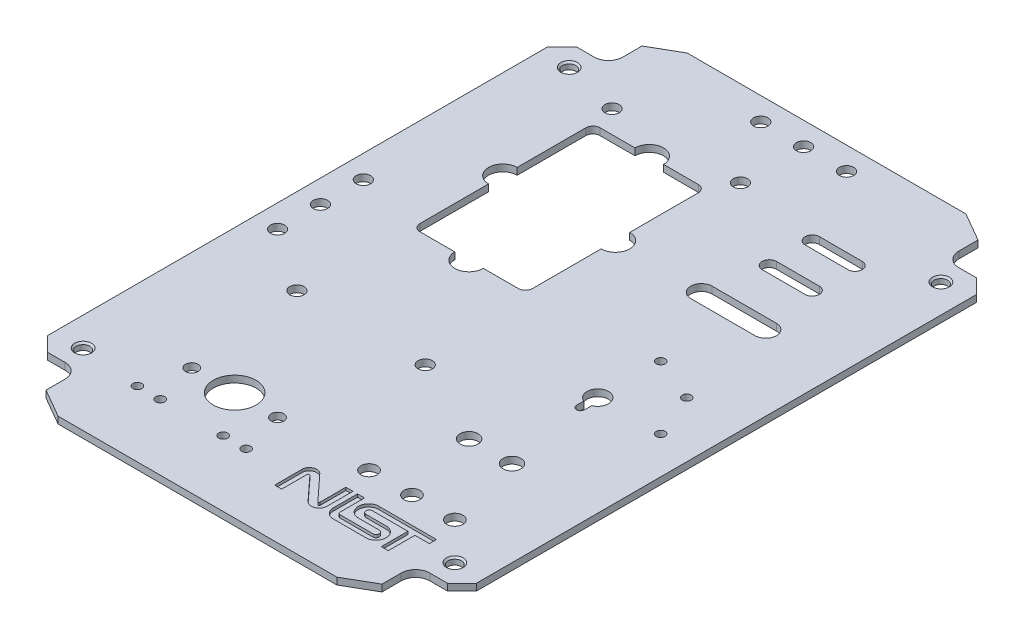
SolidWorks part; units mm, degrees
other "DetailItem1"
ref_plane "Front Plane" through (0, 0, 0) normal (0, 0, 1) x (1, 0, 0)
ref_plane "Top Plane" through (0, 0, 0) normal (0, 1, 0) x (1, 0, 0)
ref_plane "Right Plane" through (0, 0, 0) normal (1, 0, 0) x (0, 0, -1)
sketch "Sketch1" plane through (0, 0, 0) normal (0, 1, 0) x (1, 0, 0)
  line L0 (0, -55) -> (0, 55) construction
  line L1 (-74.6125, 139.7) -> (74.6125, 139.7)
  line L2 (-95.25, 117.475) -> (-95.25, -117.475)
  line L3 (-74.6125, -139.7) -> (74.6125, -139.7)
  line L4 (95.25, 117.475) -> (95.25, -117.475)
  line L5 (-55, 0) -> (55, 0) construction
  line L7 (-95.25, 117.475) -> (-74.6125, 117.475)
  line L8 (-74.6125, 139.7) -> (-74.6125, 117.475)
  line L9 (-95.25, -117.475) -> (-74.6125, -117.475)
  line L12 (-74.6125, -117.475) -> (-74.6125, -139.7)
  line L13 (74.6125, -117.475) -> (95.25, -117.475)
  line L14 (74.6125, -117.475) -> (74.6125, -139.7)
  line L22 (74.6125, 139.7) -> (74.6125, 117.475)
  line L23 (74.6125, 117.475) -> (95.25, 117.475)
  dimension "D1" = 190.5
  dimension "D2" = 95.25
  dimension "D3" = 279.4
  dimension "D4" = 139.7
  dimension "D5" = 234.95
  dimension "D6" = 117.475
  dimension "D7" = 149.225
  dimension "D8" = 74.6125
extrude "Boss-Extrude1" add sketch "Sketch1" along normal blind 3.0378
hole_wizard "15/64 (0.23438) Diameter Hole1" positions "Sketch4" profile "Sketch2" hole size "15/64" standard "ANSI Inch"
sketch "Sketch4" plane through (0, 3.0378, 0) normal (0, 1, 0) x (1, 0, 0)
  line L0 (0, -1.6708) -> (0, 1.6708) construction
  line L1 (-1.6708, 0) -> (1.6708, 0) construction
  point P0 (-82.55, -107.95)
  dimension "D1" = 82.55
  dimension "D2" = 107.95
sketch "Sketch2" plane through (-82.55, 3.0378, 107.95) normal (1, 0, 0) x (0, 0, 1)
  line L0 (0, 0) -> (0, 4.8225)
  line L1 (0, 4.8225) -> (2.9718, 3.0368)
  line L2 (2.9718, 3.0368) -> (2.9718, 0)
  line L5 (2.9718, 0) -> (0, 0)
  line L10 (0, 4.8225) -> (-2.9718, 3.0368) construction
  line L11 (0, -6.35) -> (0, 107.95) construction
  dimension "Hole Dia." = 5.9436
  dimension "Hole Depth" = 3.0368
  dimension "Drill Angle" = 118
pattern_linear "LPattern1" count 2 spacing 165.1 along (1, 0, 0) count 2 spacing 215.9 along (0, 0, -1) of "15/64 (0.23438) Diameter Hole1"
fillet "Fillet1" radius 6.35 4 edges at (74.6125, 1.5189, 117.475) (74.6125, 1.5189, -117.475) (-74.6125, 1.5189, -117.475) (-74.6125, 1.5189, 117.475)
hole_wizard "1/4 (0.25) Diameter Hole2" positions "Sketch6" profile "Sketch5" hole size "1/4" standard "ANSI Inch"
sketch "Sketch6" plane through (0, 3.0378, 0) normal (0, 1, 0) x (1, 0, 0)
  line L2 (0, -1.6708) -> (0, 1.6708) construction
  point P0 (-19.05, 129.54)
  dimension "D1" = 21.59
  dimension "D2" = 19.05
sketch "Sketch5" plane through (-19.05, 3.0378, -129.54) normal (1, 0, 0) x (0, 0, 1)
  line L0 (0, 0) -> (0, 4.9446)
  line L1 (0, 4.9446) -> (3.175, 3.0368)
  line L2 (3.175, 3.0368) -> (3.175, 0)
  line L5 (3.175, 0) -> (0, 0)
  line L10 (0, 4.9446) -> (-3.175, 3.0368) construction
  line L11 (0, -6.35) -> (0, 107.95) construction
  dimension "Hole Dia." = 6.35
  dimension "Hole Depth" = 3.0368
  dimension "Drill Angle" = 118
pattern_linear "LPattern2" count 3 spacing 19.05 along (1, 0, 0) of "1/4 (0.25) Diameter Hole2"
hole_wizard "1/4 (0.25) Diameter Hole3" positions "Sketch8" profile "Sketch7" hole size "1/4" standard "ANSI Inch"
sketch "Sketch8" plane through (0, 3.0378, 0) normal (0, 1, 0) x (1, 0, 0)
  point P0 (-57.15, 101.6)
  dimension "D1" = 6.35
  dimension "D2" = 25.4
sketch "Sketch7" plane through (-57.15, 3.0378, -101.6) normal (1, 0, 0) x (0, 0, 1)
  line L0 (0, 0) -> (0, 4.9446)
  line L1 (0, 4.9446) -> (3.175, 3.0368)
  line L2 (3.175, 3.0368) -> (3.175, 0)
  line L5 (3.175, 0) -> (0, 0)
  line L10 (0, 4.9446) -> (-3.175, 3.0368) construction
  line L11 (0, -6.35) -> (0, 107.95) construction
  dimension "Hole Dia." = 6.35
  dimension "Hole Depth" = 3.0368
  dimension "Drill Angle" = 118
pattern_linear "LPattern3" count 2 spacing 139.9997 along (0, 0, 1) count 2 spacing 56.9999 along (1, 0, 0) of "1/4 (0.25) Diameter Hole3"
sketch "Sketch9" plane through (0, 3.0378, 0) normal (0, 1, 0) x (1, 0, 0)
  line L0 (-55.65, 51.6) -> (-5.65, 51.6) construction
  line L1 (-55.65, 91.6) -> (-37, 91.6)
  line L2 (-55.65, 91.6) -> (-55.65, 57.95)
  line L3 (-55.65, 11.6) -> (-37, 11.6)
  line L4 (-5.65, 91.6) -> (-5.65, 57.95)
  line L5 (-30.65, 91.6) -> (-30.65, 11.6) construction
  line L6 (-24.3, 91.6) -> (-5.65, 91.6)
  line L7 (-55.65, 45.25) -> (-55.65, 11.6)
  line L8 (-24.3, 11.6) -> (-5.65, 11.6)
  line L9 (-5.65, 45.25) -> (-5.65, 11.6)
  arc A0 (-55.65, 57.95) -> (-55.65, 45.25) centre (-55.65, 51.6) ccw
  arc A1 (-24.3, 91.6) -> (-37, 91.6) centre (-30.65, 91.6) ccw
  arc A2 (-5.65, 45.25) -> (-5.65, 57.95) centre (-5.65, 51.6) ccw
  arc A3 (-37, 11.6) -> (-24.3, 11.6) centre (-30.65, 11.6) ccw
  dimension "D1" = 12.7
  dimension "D2" = 1.5
  dimension "D3" = 10
  dimension "D4" = 33.65
  dimension "D5" = 18.65
extrude "Cut-Extrude1" cut sketch "Sketch9" against normal through all
chamfer "Chamfer1" distance 0.762 distance2 0.762 4 edges at (-82.55, 3.0378, -104.9782) (82.55, 3.0378, -104.9782) (82.55, 3.0378, 110.9218) (-82.55, 3.0378, 110.9218)
chamfer "Chamfer2" distance 6.35 angle 45 4 edges at (-95.25, 1.5189, -117.475) (95.25, 1.5189, -117.475) (95.25, 1.5189, 117.475) (-95.25, 1.5189, 117.475)
chamfer "Chamfer3" distance 12.7 angle 30 2 edges at (74.6125, 1.5189, -139.7) (-74.6125, 1.5189, -139.7)
chamfer "Chamfer4" distance 12.7 angle 30 2 edges at (74.6125, 1.5189, 139.7) (-74.6125, 1.5189, 139.7)
hole_wizard "#2 (0.221) Diameter Hole1" positions "Sketch11" profile "Sketch10" hole size "#2" standard "ANSI Inch"
sketch "Sketch11" plane through (0, 3.0378, 0) normal (0, 1, 0) x (1, 0, 0)
  point P0 (-50.8, -91.44)
  dimension "D1" = 16.51
  dimension "D2" = 31.75
sketch "Sketch10" plane through (-50.8, 3.0378, 91.44) normal (1, 0, 0) x (0, 0, 1)
  line L0 (0, 0) -> (0, 4.7233)
  line L1 (0, 4.7233) -> (2.8067, 3.0368)
  line L2 (2.8067, 3.0368) -> (2.8067, 0)
  line L5 (2.8067, 0) -> (0, 0)
  line L10 (0, 4.7233) -> (-2.8067, 3.0368) construction
  line L11 (0, -6.35) -> (0, 107.95) construction
  dimension "Hole Dia." = 5.6134
  dimension "Hole Depth" = 3.0368
  dimension "Drill Angle" = 118
pattern_linear "LPattern4" count 2 spacing 38.1 along (1, 0, 0) of "#2 (0.221) Diameter Hole1"
hole_wizard "3/4 (0.75) Diameter Hole1" positions "Sketch13" profile "Sketch12" hole size "3/4" standard "ANSI Inch"
sketch "Sketch13" plane through (0, 3.0378, 0) normal (0, 1, 0) x (1, 0, 0)
  point P10 (-31.75, -91.44)
  dimension "D1" = 19.05
  dimension "D2" = 0
sketch "Sketch12" plane through (-31.75, 3.0378, 91.44) normal (1, 0, 0) x (0, 0, 1)
  line L0 (0, 0) -> (0, 3.0378)
  line L1 (0, 3.0378) -> (9.525, 3.0378)
  line L2 (9.525, 3.0378) -> (9.525, 0)
  line L5 (9.525, 0) -> (0, 0)
  line L11 (0, -6.35) -> (0, 107.95) construction
  dimension "Thru Hole Dia." = 19.05
  dimension "Thru Hole Depth" = 3.0378
hole_wizard "K (0.281) Diameter Hole1" positions "Sketch15" profile "Sketch14" hole size "K" standard "ANSI Inch"
sketch "Sketch15" plane through (0, 3.0378, 0) normal (0, 1, 0) x (1, 0, 0)
  point P0 (27.94, -91.44)
  dimension "D1" = 110.49
  dimension "D2" = 16.51
sketch "Sketch14" plane through (27.94, 3.0378, 91.44) normal (1, 0, 0) x (0, 0, 1)
  line L0 (0, 0) -> (0, 5.1811)
  line L1 (0, 5.1811) -> (3.5687, 3.0368)
  line L2 (3.5687, 3.0368) -> (3.5687, 0)
  line L5 (3.5687, 0) -> (0, 0)
  line L10 (0, 5.1811) -> (-3.5687, 3.0368) construction
  line L11 (0, -6.35) -> (0, 107.95) construction
  dimension "Hole Dia." = 7.1374
  dimension "Hole Depth" = 3.0368
  dimension "Drill Angle" = 118
pattern_linear "LPattern6" count 3 spacing 19.05 along (1, 0, 0) of "K (0.281) Diameter Hole1"
sketch "Sketch16" plane through (0, 3.0378, 0) normal (0, 1, 0) x (1, 0, 0)
  line L3 (52.578, -17.1182) -> (52.578, -20.32)
  line L5 (49.022, -17.1182) -> (49.022, -20.32)
  arc A0 (49.022, -20.32) -> (52.578, -20.32) centre (50.8, -20.32) ccw
  arc A1 (52.578, -17.1182) -> (49.022, -17.1182) centre (50.8, -12.7) ccw
  dimension "D1" = 31.75
  dimension "D3" = 7.62
  dimension "D4" = 9.525
  dimension "D5" = 1.778
  dimension "D2" = 95.25
extrude "Cut-Extrude2" cut sketch "Sketch16" against normal through all
hole_wizard "5/32 (0.15625) Diameter Hole1" positions "Sketch18" profile "Sketch17" hole size "5/32" standard "ANSI Inch"
sketch "Sketch18" plane through (0, 3.0378, 0) normal (0, 1, 0) x (1, 0, 0)
  point P0 (50.8, 15.24)
  dimension "D1" = 0
  dimension "D2" = 27.94
sketch "Sketch17" plane through (50.8, 3.0378, -15.24) normal (1, 0, 0) x (0, 0, 1)
  line L0 (0, 0) -> (0, 3.0378)
  line L1 (0, 3.0378) -> (1.9844, 3.0378)
  line L2 (1.9844, 3.0378) -> (1.9844, 0)
  line L5 (1.9844, 0) -> (0, 0)
  line L11 (0, -6.35) -> (0, 107.95) construction
  dimension "Thru Hole Dia." = 3.9688
  dimension "Thru Hole Depth" = 3.0378
pattern_circular "CirPattern1" count 3 every 45 about axis through (50.8, 0, 12.7) along (0, 1, 0) of "5/32 (0.15625) Diameter Hole1"
sketch "Sketch19" plane through (0, 3.0378, 0) normal (0, 1, 0) x (1, 0, 0)
  line L0 (57.15, 95.25) -> (38.1, 95.25) construction
  line L1 (57.15, 92.075) -> (38.1, 92.075)
  line L2 (57.15, 98.425) -> (38.1, 98.425)
  arc A0 (57.15, 92.075) -> (57.15, 98.425) centre (57.15, 95.25) ccw
  arc A1 (38.1, 98.425) -> (38.1, 92.075) centre (38.1, 95.25) ccw
  point P2 (47.625, 95.25)
  dimension "D3" = 12.7
  dimension "D4" = 19.05
  dimension "D1" = 3.175
  dimension "D2" = 34.925
extrude "Cut-Extrude3" cut sketch "Sketch19" against normal blind 3.0378
pattern_linear "LPattern7" count 2 spacing 19.05 along (0, 0, 1) of "Cut-Extrude3"
sketch "Sketch20" plane through (0, 3.0378, 0) normal (0, 1, 0) x (1, 0, 0)
  line L0 (61.9125, 50.8) -> (33.3375, 50.8) construction
  line L1 (61.9125, 46.0375) -> (33.3375, 46.0375)
  line L2 (61.9125, 55.5625) -> (33.3375, 55.5625)
  arc A0 (61.9125, 46.0375) -> (61.9125, 55.5625) centre (61.9125, 50.8) ccw
  arc A1 (33.3375, 55.5625) -> (33.3375, 46.0375) centre (33.3375, 50.8) ccw
  point P2 (47.625, 50.8)
  dimension "D4" = 34.925
  dimension "D2" = 28.575
  dimension "D1" = 9.525
  dimension "D3" = 57.15
extrude "Cut-Extrude4" cut sketch "Sketch20" against normal blind 3.0378
hole_wizard "1/4 (0.25) Diameter Hole6" positions "Sketch22" profile "Sketch21" hole size "1/4" standard "ANSI Inch"
sketch "Sketch22" plane through (0, 3.0378, 0) normal (0, 1, 0) x (1, 0, 0)
  line L1 (-1.6708, 0) -> (1.6708, 0) construction
  point P0 (-85.09, -19.05)
  dimension "D1" = 19.05
  dimension "D2" = 2.54
sketch "Sketch21" plane through (-85.09, 3.0378, 19.05) normal (1, 0, 0) x (0, 0, 1)
  line L0 (0, 0) -> (0, 3.0378)
  line L1 (0, 3.0378) -> (3.175, 3.0378)
  line L2 (3.175, 3.0378) -> (3.175, 0)
  line L5 (3.175, 0) -> (0, 0)
  line L11 (0, -6.35) -> (0, 107.95) construction
  dimension "Thru Hole Dia." = 6.35
  dimension "Thru Hole Depth" = 3.0378
pattern_linear "LPattern8" count 3 spacing 19.05 along (0, 0, -1) of "1/4 (0.25) Diameter Hole6"
fillet "Fillet2" radius 3.175 4 edges at (-5.65, 1.5189, -11.6) (-5.65, 1.5189, -91.6) (-55.65, 1.5189, -11.6) (-55.65, 1.5189, -91.6)
hole_wizard "5/32 (0.15625) Diameter Hole2" positions "Sketch26" profile "Sketch25" hole size "5/32" standard "ANSI Inch"
sketch "Sketch26" plane through (0, 3.0378, 0) normal (0, 1, 0) x (1, 0, 0)
  point P0 (-45.72, -110.49)
  dimension "D1" = 19.05
  dimension "D2" = 13.97
sketch "Sketch25" plane through (-45.72, 3.0378, 110.49) normal (1, 0, 0) x (0, 0, 1)
  line L0 (0, 0) -> (0, 4.2292)
  line L1 (0, 4.2292) -> (1.9844, 3.0368)
  line L2 (1.9844, 3.0368) -> (1.9844, 0)
  line L5 (1.9844, 0) -> (0, 0)
  line L10 (0, 4.2292) -> (-1.9844, 3.0368) construction
  line L11 (0, -6.35) -> (0, 107.95) construction
  dimension "Hole Dia." = 3.9688
  dimension "Hole Depth" = 3.0368
  dimension "Drill Angle" = 118
pattern_linear "LPattern9" count 2 spacing 10.16 along (-1, 0, 0) of "5/32 (0.15625) Diameter Hole2"
pattern_linear "LPattern10" count 2 spacing 38.1 along (1, 0, 0) of "LPattern9"
hole_wizard "O (0.316) Diameter Hole1" positions "Sketch28" profile "Sketch27" hole size "O" standard "ANSI Inch"
sketch "Sketch28" plane through (0, 3.0378, 0) normal (0, 1, 0) x (1, 0, 0)
  point P0 (57.15, -57.15)
  dimension "D1" = 50.8
  dimension "D2" = 25.4
sketch "Sketch27" plane through (57.15, 3.0378, 57.15) normal (1, 0, 0) x (0, 0, 1)
  line L0 (0, 0) -> (0, 3.0378)
  line L1 (0, 3.0378) -> (4.0005, 3.0378)
  line L2 (4.0005, 3.0378) -> (4.0005, 0)
  line L5 (4.0005, 0) -> (0, 0)
  line L11 (0, -6.35) -> (0, 107.95) construction
  dimension "Thru Hole Dia." = 8.001
  dimension "Thru Hole Depth" = 3.0378
pattern_linear "LPattern11" count 2 spacing 19.05 along (-1, 0, 0) of "O (0.316) Diameter Hole1"
ref_point "Point1"
sketch "Sketch29" plane through (0, 3.0378, 0) normal (0, 1, 0) x (1, 0, 0)
  line L0 (-0.1501, -38.3997) -> (-57.15, 101.6) construction
  line L1 (-0.1501, 101.6) -> (-57.15, -38.3997) construction
  point P8 (-28.6501, 31.6001)
ref_point "Point2"
ref_point "Point3"
sketch "Sketch30" plane through (0, 3.0378, 0) normal (0, 1, 0) x (1, 0, 0)
  line L0 (82.3369, 0.762) -> (82.3369, -2.54)
  line L1 (82.3369, -2.54) -> (84.5723, -1.769)
  line L2 (84.5723, -1.769) -> (82.3369, 0.762)
  line L3 (64.3575, 18.796) -> (61.8655, 20.9623)
  line L4 (61.8655, 20.9623) -> (60.9808, 18.7695)
  line L5 (60.9808, 18.7695) -> (64.3575, 18.796)
  arc A0 (64.3575, 18.796) -> (82.3369, 0.762) centre (50.8, -12.7) ccw
  text T0 "C" font "Century Schoolbook" height 7.62
  dimension "D1" = 68.58
  dimension "D2" = 31.496
  dimension "D3" = 70.97
  dimension "D4" = 41.45
  dimension "D5" = 3.302
  dimension "D6" = 21.59
  dimension "D7" = 21.844
  dimension "D8" = 41.45
sketch "Sketch31" plane through (0, 3.0378, 0) normal (0, 1, 0) x (1, 0, 0)
  line L0 (50.8, 10.16) -> (50.8, 20.32)
  line L1 (66.9645, 3.4645) -> (74.1487, 10.6487)
  line L2 (73.66, -12.7) -> (83.82, -12.7)
  arc A0 (74.2176, 2.54) -> (66.8644, 10.16) centre (50.8, -12.7) ccw
  dimension "D1" = 10.16
  dimension "D2" = 45
  dimension "D3" = 15.24
  dimension "D4" = 22.86
sketch "Sketch32" plane through (0, 3.0378, 0) normal (0, 1, 0) x (1, 0, 0)
  line L0 (66.04, -83.82) -> (66.04, -99.06)
  line L1 (58.42, -91.44) -> (73.66, -91.44)
  dimension "D1" = 15.24
sketch "Sketch33" plane through (0, 3.0378, 0) normal (0, 1, 0) x (1, 0, 0)
  line L0 (0, -1.6708) -> (0, 1.6708) construction
  line L1 (-61.9125, -139.7) -> (61.9125, -139.7) construction
  line L2 (34.4811, -103.11) -> (34.4811, -113.9143)
  line L3 (38.6768, -118.11) -> (53.8773, -118.11)
  line L4 (53.8773, -109.0871) -> (44.2506, -109.0871)
  line L5 (44.3655, -106.271) -> (60.0556, -106.271)
  line L6 (60.0556, -106.271) -> (60.0556, -118.11)
  line L7 (60.0556, -118.11) -> (63.1581, -118.11)
  line L8 (63.1581, -118.11) -> (63.1581, -106.271)
  line L9 (63.1581, -106.271) -> (69.5674, -106.271)
  line L10 (69.5674, -106.271) -> (69.5674, -103.11)
  line L11 (69.5674, -103.11) -> (43.9641, -103.11)
  line L12 (44.3081, -112.1904) -> (53.3599, -112.1904)
  line L13 (53.4174, -115.0068) -> (38.7059, -115.0068)
  line L14 (37.6134, -113.9143) -> (37.6134, -103.11)
  line L15 (37.6134, -103.11) -> (34.4811, -103.11)
  line L16 (12.7, -118.11) -> (12.7, -105.9479)
  line L17 (18.3552, -103.7339) -> (28.62, -114.8343)
  line L18 (29.3377, -114.5181) -> (29.3377, -103.11)
  line L19 (29.3377, -103.11) -> (32.4699, -103.11)
  line L20 (32.4699, -103.11) -> (32.4699, -114.5929)
  line L21 (26.2068, -116.7906) -> (16.7397, -106.501)
  line L22 (15.8025, -106.8665) -> (15.8025, -118.11)
  line L23 (15.8025, -118.11) -> (12.7, -118.11)
  arc A0 (34.4811, -113.9143) -> (38.6768, -118.11) centre (38.6768, -113.9143) ccw
  arc A1 (53.8773, -118.11) -> (53.8773, -109.0871) centre (53.1589, -113.5985) ccw
  arc A2 (44.3655, -106.271) -> (44.2506, -109.0871) centre (44.2506, -107.6767) ccw
  arc A3 (43.9641, -103.11) -> (44.3081, -112.1904) centre (43.9641, -107.6567) ccw
  arc A4 (53.4174, -115.0068) -> (53.3599, -112.1904) centre (53.2372, -113.6017) ccw
  arc A5 (18.3552, -103.7339) -> (12.7, -105.9479) centre (15.961, -105.9479) ccw
  arc A6 (28.62, -114.8343) -> (29.3377, -114.5181) centre (28.9245, -114.5528) ccw
  arc A7 (16.7397, -106.501) -> (15.8025, -106.8665) centre (16.3424, -106.8665) ccw
  arc A8 (37.6134, -113.9143) -> (38.7059, -115.0068) centre (38.7059, -113.9143) ccw
  arc A9 (26.2068, -116.7906) -> (32.4699, -114.5929) centre (28.9528, -114.5929) ccw
  point P0 (12.7, -118.11)
  point P5 (12.7, -118.11)
  dimension "D1" = 12.7
  dimension "D2" = 21.59
extrude "Cut-Extrude5" cut sketch "Sketch33" against normal blind 1.27
